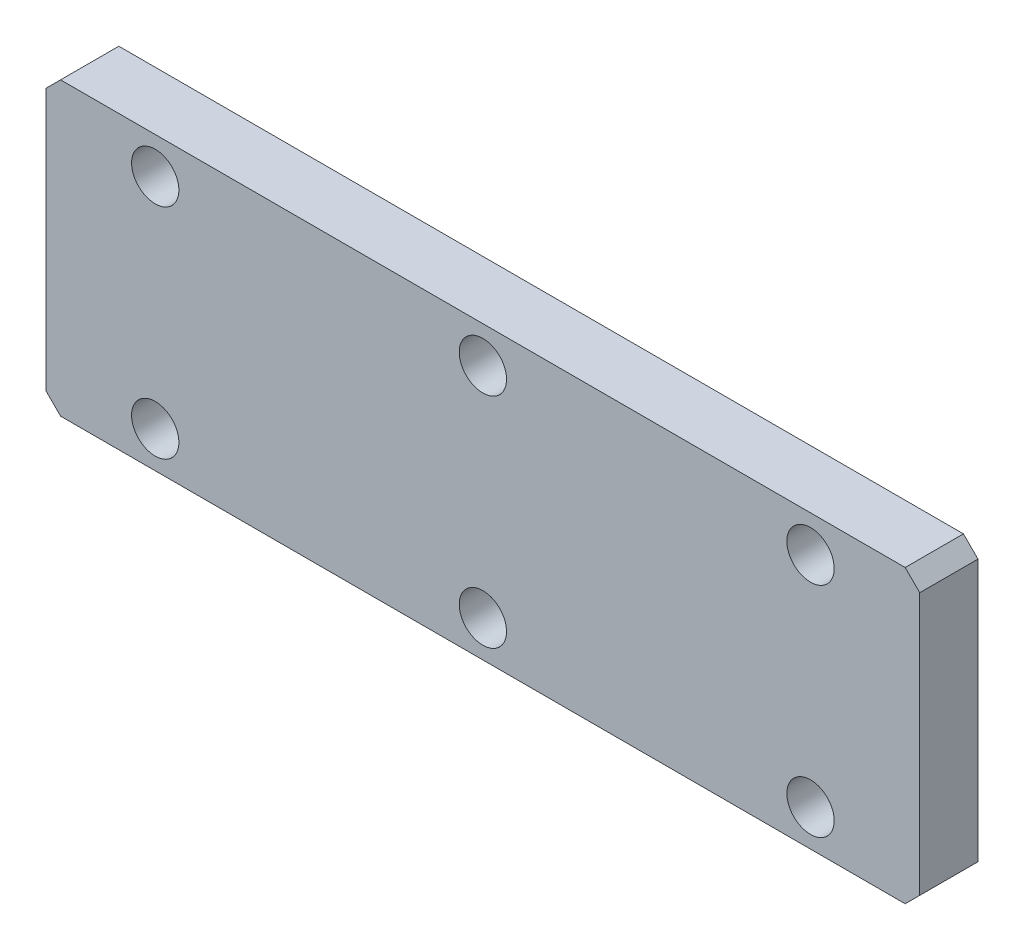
SolidWorks part; units mm, degrees
ref_plane "Face" through (0, 0, 0) normal (0, 0, 1) x (1, 0, 0)
ref_plane "Dessus" through (0, 0, 0) normal (0, 1, 0) x (1, 0, 0)
ref_plane "Droite" through (0, 0, 0) normal (1, 0, 0) x (0, 0, -1)
sketch "Esquisse1" plane through (0, 0, 0) normal (0, 0, 1) x (1, 0, 0)
  line L0 (105, 5) -> (60, 5) construction
  line L1 (0, 0) -> (120, 0)
  line L2 (0, 0) -> (0, 40)
  line L3 (0, 40) -> (120, 40)
  line L4 (120, 0) -> (120, 40)
  line L5 (105, 5) -> (105, 35) construction
  circle A0 centre (105, 5) radius 3.25
  circle A1 centre (60, 5) radius 3.25
  circle A2 centre (15, 5) radius 3.25
  circle A3 centre (105, 35) radius 3.25
  circle A4 centre (60, 35) radius 3.25
  circle A5 centre (15, 35) radius 3.25
  dimension "D3" = 5
  dimension "D4" = 15
  dimension "D5" = 6.5
  dimension "D1" = 40
  dimension "D2" = 120
  dimension "D6" = 90
extrude "Extrusion1" add sketch "Esquisse1" along normal blind 8
chamfer "Chanfrein1" distance 2 angle 45 4 edges at (0, 40, 4) (120, 40, 4) (120, 0, 4) (0, 0, 4)
